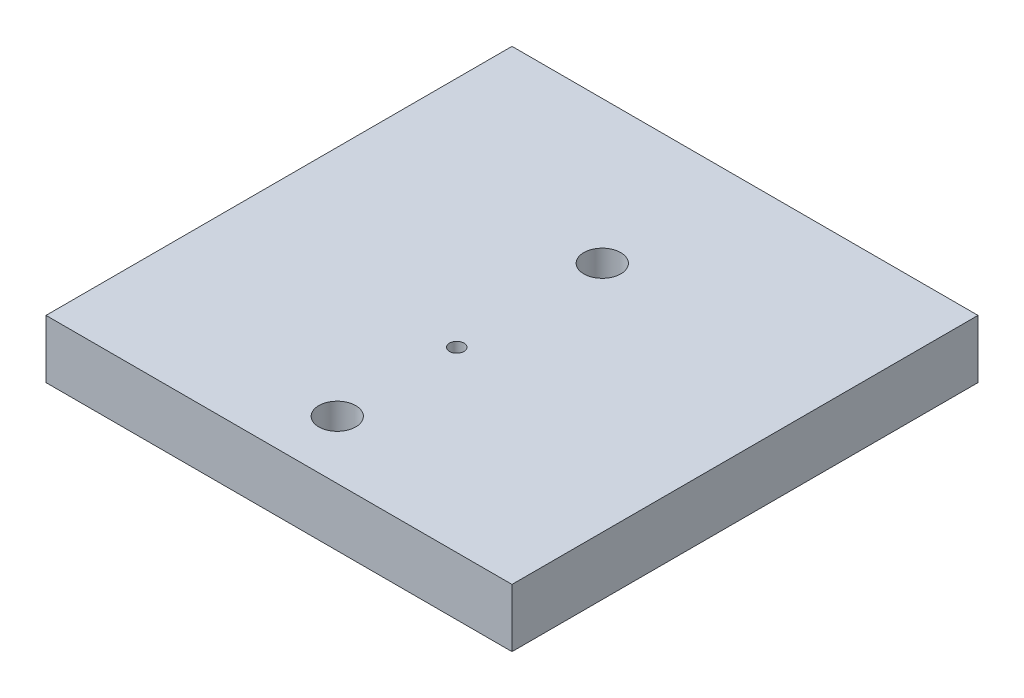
SolidWorks part; units mm, degrees
ref_plane "Front Plane" through (0, 0, 0) normal (0, 0, 1) x (1, 0, 0)
ref_plane "Top Plane" through (0, 0, 0) normal (0, 1, 0) x (1, 0, 0)
ref_plane "Right Plane" through (0, 0, 0) normal (1, 0, 0) x (0, 0, -1)
sketch "Sketch1" plane through (0, 0, 0) normal (0, 1, 0) x (1, 0, 0)
  line L1 (-40, -40) -> (40, -40)
  line L2 (-40, -40) -> (-40, 40)
  line L3 (-40, 40) -> (40, 40)
  line L4 (40, -40) -> (40, 40)
  line L5 (-40, -40) -> (40, 40) construction
  line L6 (-40, 40) -> (40, -40) construction
  point P0 (0, 0)
  dimension "D1" = 80
  dimension "D2" = 80
extrude "Boss-Extrude1" add sketch "Sketch1" along normal blind 10
sketch "Sketch2" plane through (0, 10, 0) normal (0, 1, 0) x (1, 0, 0)
  line L0 (0, -40) -> (0, 40) construction
  line L1 (-40, -40) -> (40, -40) construction
  line L2 (40, 40) -> (-40, 40) construction
  circle A0 centre (0, -30) radius 3.175
  circle A1 centre (0, -9.49) radius 1.25
  circle A2 centre (0, 15.5) radius 3.175
  dimension "D1" = 6.35
  dimension "D3" = 6.35
  dimension "D4" = 2.5
  dimension "D2" = 10
  dimension "D5" = 30.51
  dimension "D6" = 55.5
extrude "Cut-Extrude1" cut sketch "Sketch2" against normal blind 10
